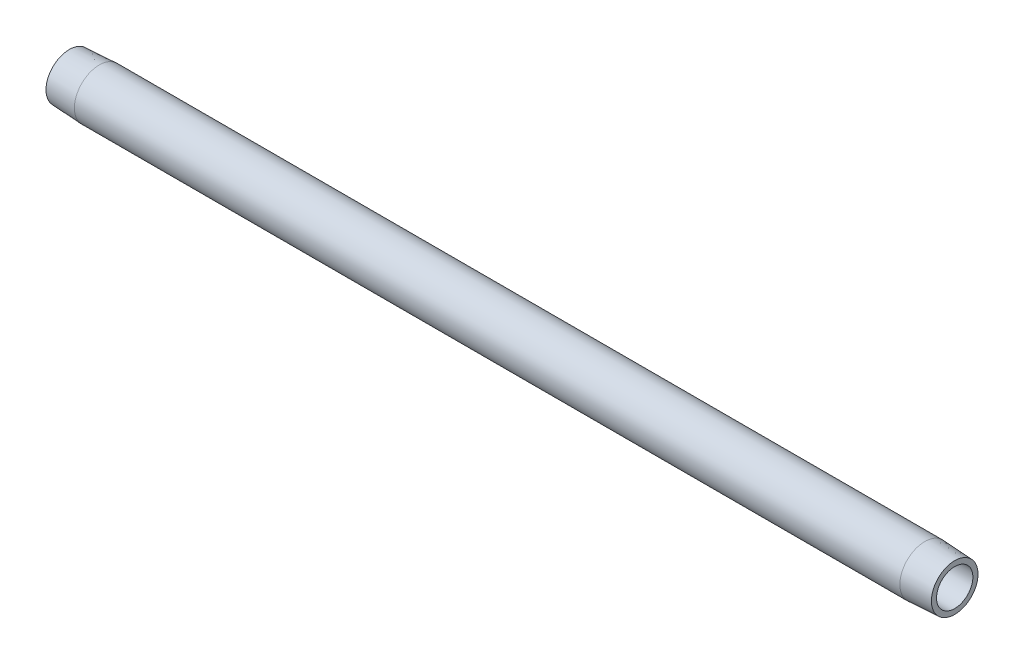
SolidWorks part; units mm, degrees
ref_plane "Front Plane" through (0, 0, 0) normal (0, 0, 1) x (1, 0, 0)
ref_plane "Top Plane" through (0, 0, 0) normal (0, 1, 0) x (1, 0, 0)
ref_plane "Right Plane" through (0, 0, 0) normal (1, 0, 0) x (0, 0, -1)
sketch "Sketch1" plane through (0, 0, 0) normal (0, 0, 1) x (1, 0, 0)
  line L5 (304.8, 6.2611) -> (0, 6.2611)
  line L6 (294.4876, 8.5725) -> (10.3124, 8.5725)
  line L7 (10.3124, 8.5725) -> (0, 8.0321)
  line L8 (304.8, 8.0321) -> (294.4876, 8.5725)
  line L9 (304.8, 6.2611) -> (304.8, 8.0321)
  line L10 (0, 6.2611) -> (0, 8.0321)
  line L11 (0, 0) -> (50000, 0) construction
  line L12 (0, -55) -> (0, 55) construction
  dimension "D1" = 12.5222
  dimension "D2" = 17.145
  dimension "D3" = 3
  dimension "D4" = 3
  dimension "D5" = 304.8
  dimension "D6" = 10.3124
  dimension "D7" = 10.3124
revolve "Revolve1" add sketch "Sketch1" angle 360 about L11
